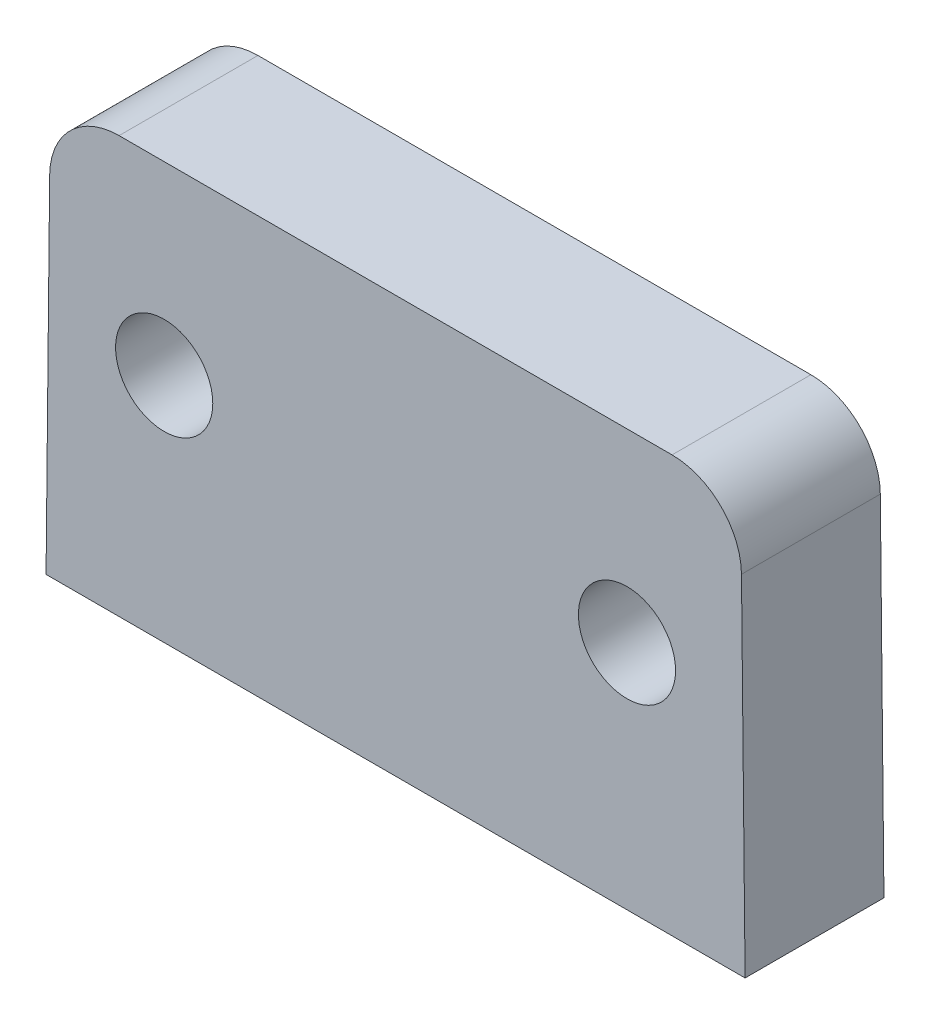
SolidWorks part; units mm, degrees
ref_plane "Спереди" through (0, 0, 0) normal (0, 0, 1) x (1, 0, 0)
ref_plane "Сверху" through (0, 0, 0) normal (0, 1, 0) x (1, 0, 0)
ref_plane "Справа" through (0, 0, 0) normal (1, 0, 0) x (0, 0, -1)
sketch "Эскиз1" plane through (0, 0, 0) normal (0, 0, 1) x (1, 0, 0)
  line L1 (0, 0) -> (30.2084, 0)
  line L2 (0, 0) -> (0.1562, 15.0312)
  line L3 (3.1561, 18) -> (27.0523, 18)
  line L4 (30.2084, 0) -> (30.0522, 15.0312)
  circle A0 centre (15.1042, 10) radius 4 construction
  circle A1 centre (5.1042, 10) radius 2.1
  circle A2 centre (25.1042, 10) radius 2.1
  arc A3 (30.0522, 15.0312) -> (27.0523, 18) centre (27.0523, 15) ccw
  arc A4 (0.1562, 15.0312) -> (3.1561, 18) centre (3.1561, 15) cw
  point P7 (15.1042, 18)
  dimension "D1" = 8
  dimension "D4" = 4.2
  dimension "D5" = 4.2
  dimension "D8" = 3
  dimension "D2" = 10
  dimension "D3" = 8
  dimension "D6" = 10
  dimension "D7" = 5
  dimension "D9" = 10
  dimension "D10" = 5
extrude "Бобышка-Вытянуть1" add sketch "Эскиз1" along normal blind 6
